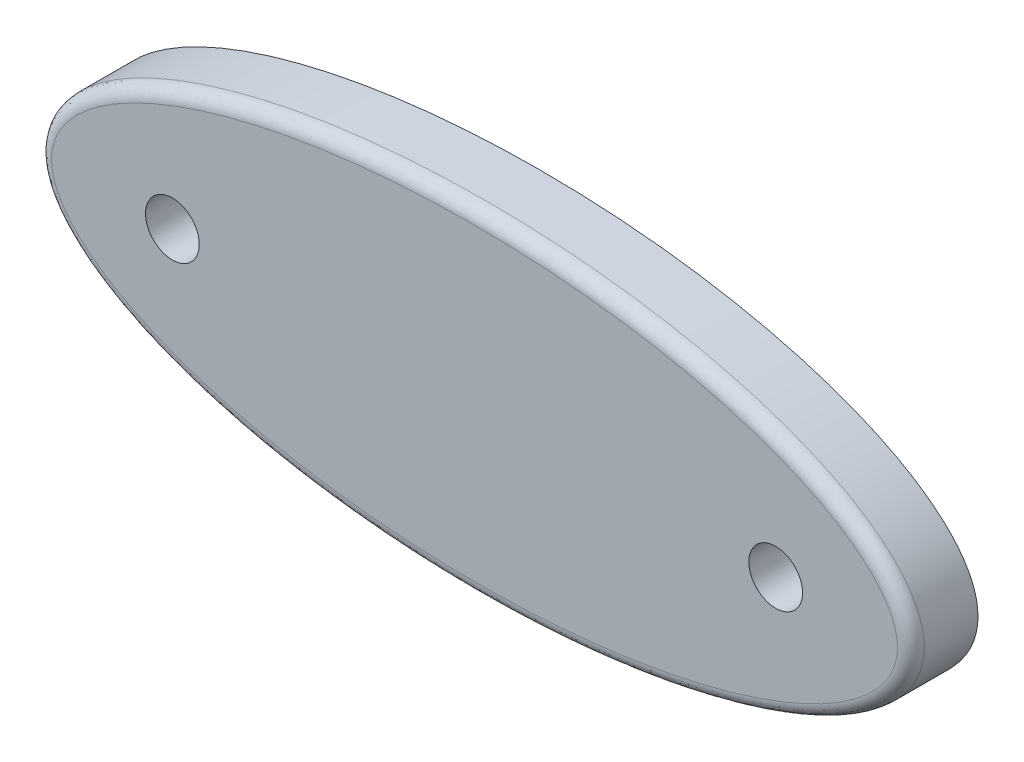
SolidWorks part; units mm, degrees
ref_plane "Face" through (0, 0, 0) normal (0, 0, 1) x (1, 0, 0)
ref_plane "Dessus" through (0, 0, 0) normal (0, 1, 0) x (1, 0, 0)
ref_plane "Droite" through (0, 0, 0) normal (1, 0, 0) x (0, 0, -1)
sketch "Esquisse1" plane through (0, 0, 0) normal (0, 0, 1) x (1, 0, 0)
  line L0 (-65, 0) -> (65, 0) construction
  circle A0 centre (45, 0) radius 2
  circle A1 centre (-45, 0) radius 2
  ellipse E0 centre (0, 0) end of major axis (-65, 0) minor radius 25
  dimension "D1" = 90
  dimension "D2" = 45
  dimension "D3" = 4
  dimension "D4" = 130
  dimension "D5" = 50
extrude "Extrusion1" add sketch "Esquisse1" along normal blind 10
sketch "Esquisse2" plane through (0, 0, 10) normal (0, 0, 1) x (1, 0, 0)
  circle A0 centre (-45, 0) radius 4
  circle A1 centre (44.8647, 0) radius 4
  dimension "D1" = 8
extrude "Enlèv. mat.-Extru.1" cut sketch "Esquisse2" against normal blind 6
fillet "Congé1" radius 2
sketch "Esquisse3" plane through (0, 0, 0) normal (0, 0, -1) x (-1, 0, 0)
  arc A0 (-0.3333, 0.7454) -> (-0.3333, -0.7454) centre (-1, 0) ccw
  arc A1 (0.3333, -0.7454) -> (0.3333, 0.7454) centre (1, 0) ccw
  arc A2 (-0.3333, 0.7454) -> (0.3333, 0.7454) centre (0, 1.118) ccw
  arc A3 (0.3333, -0.7454) -> (-0.3333, -0.7454) centre (0, -1.118) ccw
  dimension "D1" = 2
  dimension "D3" = 1
  dimension "D2" = 1
extrude "Extrusion6" add sketch "Esquisse3" along normal blind 10
